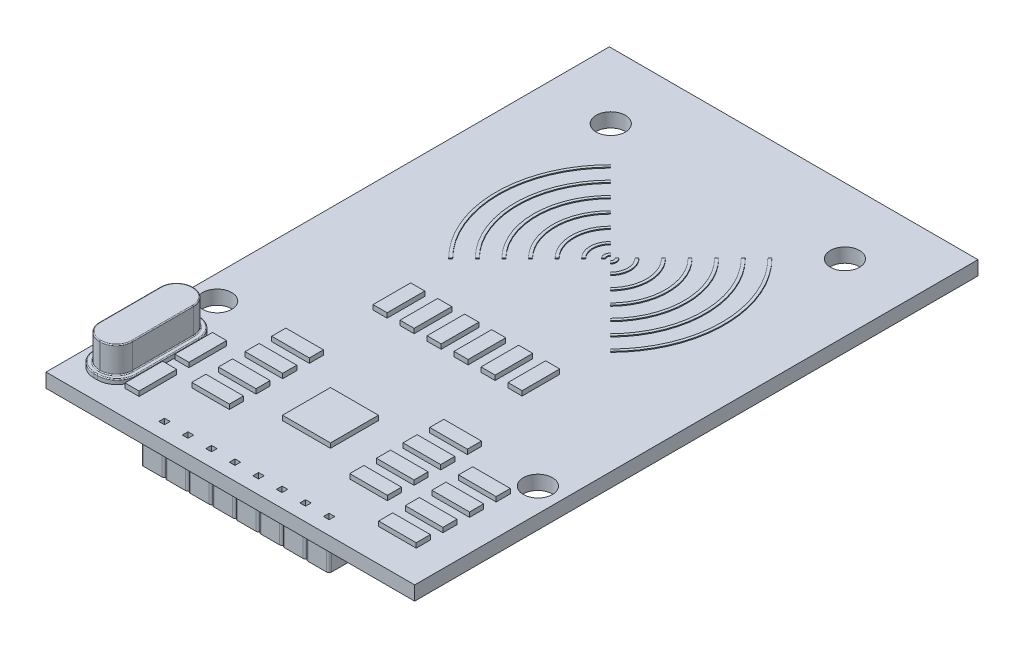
SolidWorks part; units mm, degrees
ref_plane "Front Plane" through (0, 0, 0) normal (0, 0, 1) x (1, 0, 0)
ref_plane "Top Plane" through (0, 0, 0) normal (0, 1, 0) x (1, 0, 0)
ref_plane "Right Plane" through (0, 0, 0) normal (1, 0, 0) x (0, 0, -1)
sketch "Sketch1" plane through (0, 0, 0) normal (0, 1, 0) x (1, 0, 0)
  line L1 (-19.6, 29.95) -> (19.6, 29.95)
  line L2 (-19.6, 29.95) -> (-19.6, -29.95)
  line L3 (-19.6, -29.95) -> (19.6, -29.95)
  line L4 (19.6, 29.95) -> (19.6, -29.95)
  line L5 (-19.6, 29.95) -> (19.6, -29.95) construction
  line L6 (-19.6, -29.95) -> (19.6, 29.95) construction
  point P0 (0, 0)
  dimension "D1" = 39.2
  dimension "D2" = 59.9
extrude "Boss-Extrude1" add sketch "Sketch1" along normal blind 1.5
sketch "Sketch3" plane through (0, 1.5, 0) normal (0, 1, 0) x (1, 0, 0)
  line L0 (0, 29.95) -> (0, -29.95) construction
  line L2 (19.6, 29.95) -> (-19.6, 29.95) construction
  line L3 (-17.05, -14.3) -> (17.05, -14.3) construction
  line L4 (-12.45, 22.95) -> (12.45, 22.95) construction
  line L5 (-19.6, -29.95) -> (19.6, -29.95) construction
  circle A0 centre (12.45, 22.95) radius 1.55
  circle A1 centre (-12.45, 22.95) radius 1.55
  circle A2 centre (17.05, -14.3) radius 1.55
  circle A3 centre (-17.05, -14.3) radius 1.55
  point P16 (0, 22.95)
  point P17 (0, -14.3)
  dimension "D1" = 3.1
  dimension "D2" = 12.45
  dimension "D3" = 7
  dimension "D6" = 17.05
  dimension "D7" = 15.65
extrude "Cut-Extrude1" cut sketch "Sketch3" against normal up to surface (1.5 mm away)
sketch "Sketch4" plane through (0, 0, 0) normal (0, 1, 0) x (1, 0, 0)
  line L0 (-19.6, -29.95) -> (19.6, -29.95) construction
  line L1 (-9.75, -26.95) -> (-7.75, -26.95)
  line L2 (-10, -27.2) -> (-10, -29.2)
  line L3 (-9.75, -29.45) -> (-7.75, -29.45)
  line L5 (-19.6, 29.95) -> (-19.6, -29.95) construction
  line L7 (-7.25, -29.45) -> (-5.25, -29.45)
  line L9 (-7.25, -26.95) -> (-5.25, -26.95)
  line L11 (-4.75, -29.45) -> (-2.75, -29.45)
  line L13 (-4.75, -26.95) -> (-2.75, -26.95)
  line L15 (-2.25, -29.45) -> (-0.25, -29.45)
  line L17 (-2.25, -26.95) -> (-0.25, -26.95)
  line L19 (0.25, -29.45) -> (2.25, -29.45)
  line L21 (0.25, -26.95) -> (2.25, -26.95)
  line L23 (2.75, -29.45) -> (4.75, -29.45)
  line L25 (2.75, -26.95) -> (4.75, -26.95)
  line L27 (5.25, -29.45) -> (7.25, -29.45)
  line L29 (5.25, -26.95) -> (7.25, -26.95)
  line L30 (10, -27.2) -> (10, -29.2)
  line L31 (7.75, -29.45) -> (9.75, -29.45)
  line L33 (7.75, -26.95) -> (9.75, -26.95)
  line L34 (-7.5, -27.2) -> (-7.5, -29.2)
  line L35 (-5, -27.2) -> (-5, -29.2)
  line L36 (-2.5, -27.2) -> (-2.5, -29.2)
  line L37 (0, -27.2) -> (0, -29.2)
  line L38 (2.5, -27.2) -> (2.5, -29.2)
  line L39 (5, -27.2) -> (5, -29.2)
  line L40 (7.5, -27.2) -> (7.5, -29.2)
  arc A1 (-7.75, -26.95) -> (-7.5, -27.2) centre (-7.75, -27.2) cw
  arc A2 (-7.5, -29.2) -> (-7.75, -29.45) centre (-7.75, -29.2) cw
  arc A3 (-9.75, -29.45) -> (-10, -29.2) centre (-9.75, -29.2) cw
  arc A4 (-10, -27.2) -> (-9.75, -26.95) centre (-9.75, -27.2) cw
  arc A5 (-5, -29.2) -> (-5.25, -29.45) centre (-5.25, -29.2) cw
  arc A6 (-7.25, -29.45) -> (-7.5, -29.2) centre (-7.25, -29.2) cw
  arc A7 (-7.5, -27.2) -> (-7.25, -26.95) centre (-7.25, -27.2) cw
  arc A8 (-5.25, -26.95) -> (-5, -27.2) centre (-5.25, -27.2) cw
  arc A10 (-2.5, -29.2) -> (-2.75, -29.45) centre (-2.75, -29.2) cw
  arc A11 (-4.75, -29.45) -> (-5, -29.2) centre (-4.75, -29.2) cw
  arc A12 (-5, -27.2) -> (-4.75, -26.95) centre (-4.75, -27.2) cw
  arc A13 (-2.75, -26.95) -> (-2.5, -27.2) centre (-2.75, -27.2) cw
  arc A15 (0, -29.2) -> (-0.25, -29.45) centre (-0.25, -29.2) cw
  arc A16 (-2.25, -29.45) -> (-2.5, -29.2) centre (-2.25, -29.2) cw
  arc A17 (-2.5, -27.2) -> (-2.25, -26.95) centre (-2.25, -27.2) cw
  arc A18 (-0.25, -26.95) -> (0, -27.2) centre (-0.25, -27.2) cw
  arc A20 (2.5, -29.2) -> (2.25, -29.45) centre (2.25, -29.2) cw
  arc A21 (0.25, -29.45) -> (0, -29.2) centre (0.25, -29.2) cw
  arc A22 (0, -27.2) -> (0.25, -26.95) centre (0.25, -27.2) cw
  arc A23 (2.25, -26.95) -> (2.5, -27.2) centre (2.25, -27.2) cw
  arc A25 (5, -29.2) -> (4.75, -29.45) centre (4.75, -29.2) cw
  arc A26 (2.75, -29.45) -> (2.5, -29.2) centre (2.75, -29.2) cw
  arc A27 (2.5, -27.2) -> (2.75, -26.95) centre (2.75, -27.2) cw
  arc A28 (4.75, -26.95) -> (5, -27.2) centre (4.75, -27.2) cw
  arc A30 (7.5, -29.2) -> (7.25, -29.45) centre (7.25, -29.2) cw
  arc A31 (5.25, -29.45) -> (5, -29.2) centre (5.25, -29.2) cw
  arc A32 (5, -27.2) -> (5.25, -26.95) centre (5.25, -27.2) cw
  arc A33 (7.25, -26.95) -> (7.5, -27.2) centre (7.25, -27.2) cw
  arc A35 (10, -29.2) -> (9.75, -29.45) centre (9.75, -29.2) cw
  arc A36 (7.75, -29.45) -> (7.5, -29.2) centre (7.75, -29.2) cw
  arc A37 (7.5, -27.2) -> (7.75, -26.95) centre (7.75, -27.2) cw
  arc A38 (9.75, -26.95) -> (10, -27.2) centre (9.75, -27.2) cw
  point P12 (-7.5, -26.95)
  point P17 (-10, -29.45)
  point P20 (-10, -26.95)
  dimension "D7" = 0.25
  dimension "D1" = 2.5
  dimension "D2" = 2.5
  dimension "D3" = 0.5
  dimension "D4" = 9.6
  dimension "D8" = 8
extrude "Boss-Extrude3" add sketch "Sketch4" against normal blind 2.5
sketch "Sketch5" plane through (0, -2.5, 0) normal (0, -1, 0) x (-1, 0, 0)
  line L0 (-10, -29.2) -> (-10, -27.2) construction
  line L2 (7.75, -26.95) -> (9.75, -26.95) construction
  line L3 (-9.05, -27.9) -> (-8.45, -27.9)
  line L4 (-9.05, -27.9) -> (-9.05, -28.5)
  line L5 (-9.05, -28.5) -> (-8.45, -28.5)
  line L6 (-8.45, -27.9) -> (-8.45, -28.5)
  line L8 (-6.55, -27.9) -> (-5.95, -27.9)
  line L9 (-5.95, -27.9) -> (-5.95, -28.5)
  line L10 (-6.55, -28.5) -> (-5.95, -28.5)
  line L11 (-6.55, -27.9) -> (-6.55, -28.5)
  line L12 (-4.05, -27.9) -> (-3.45, -27.9)
  line L13 (-3.45, -27.9) -> (-3.45, -28.5)
  line L14 (-4.05, -28.5) -> (-3.45, -28.5)
  line L15 (-4.05, -27.9) -> (-4.05, -28.5)
  line L16 (-1.55, -27.9) -> (-0.95, -27.9)
  line L17 (-0.95, -27.9) -> (-0.95, -28.5)
  line L18 (-1.55, -28.5) -> (-0.95, -28.5)
  line L19 (-1.55, -27.9) -> (-1.55, -28.5)
  line L20 (0.95, -27.9) -> (1.55, -27.9)
  line L21 (1.55, -27.9) -> (1.55, -28.5)
  line L22 (0.95, -28.5) -> (1.55, -28.5)
  line L23 (0.95, -27.9) -> (0.95, -28.5)
  line L24 (3.45, -27.9) -> (4.05, -27.9)
  line L25 (4.05, -27.9) -> (4.05, -28.5)
  line L26 (3.45, -28.5) -> (4.05, -28.5)
  line L27 (3.45, -27.9) -> (3.45, -28.5)
  line L28 (5.95, -27.9) -> (6.55, -27.9)
  line L29 (6.55, -27.9) -> (6.55, -28.5)
  line L30 (5.95, -28.5) -> (6.55, -28.5)
  line L31 (5.95, -27.9) -> (5.95, -28.5)
  line L32 (8.45, -27.9) -> (9.05, -27.9)
  line L33 (9.05, -27.9) -> (9.05, -28.5)
  line L34 (8.45, -28.5) -> (9.05, -28.5)
  line L35 (8.45, -27.9) -> (8.45, -28.5)
  dimension "D1" = 0.6
  dimension "D2" = 0.6
  dimension "D3" = 0.95
  dimension "D4" = 0.95
  dimension "D5" = 8
extrude "Cut-Extrude2" cut sketch "Sketch5" against normal up to surface (4 mm away)
sketch "Sketch8" plane through (0, 1.5, 0) normal (0, 1, 0) x (1, 0, 0)
  line L0 (-19.6, -29.95) -> (19.6, -29.95) construction
  line L1 (-16.5, -17.15) -> (-16.15, -17.15)
  line L2 (-18.6, -19.25) -> (-18.6, -25.85)
  line L3 (-16.5, -27.95) -> (-16.15, -27.95)
  line L4 (-14.05, -19.25) -> (-14.05, -25.85)
  line L6 (-19.6, 29.95) -> (-19.6, -29.95) construction
  arc A0 (-18.6, -25.85) -> (-16.5, -27.95) centre (-16.5, -25.85) ccw
  arc A1 (-16.15, -27.95) -> (-14.05, -25.85) centre (-16.15, -25.85) ccw
  arc A2 (-16.15, -17.15) -> (-14.05, -19.25) centre (-16.15, -19.25) cw
  arc A3 (-16.5, -17.15) -> (-18.6, -19.25) centre (-16.5, -19.25) ccw
  point P6 (-18.6, -27.95)
  point P11 (-14.05, -17.15)
  point P14 (-18.6, -17.15)
  dimension "D3" = 2.1
  dimension "D1" = 10.8
  dimension "D2" = 4.55
  dimension "D4" = 1
  dimension "D5" = 2
extrude "Boss-Extrude4" add sketch "Sketch8" along normal blind 0.5
sketch "Sketch10" plane through (0, 2, 0) normal (0, 1, 0) x (1, 0, 0)
  line L0 (-16.325, -17.15) -> (-16.325, -27.95) construction
  line L1 (-16.15, -17.15) -> (-16.5, -17.15) construction
  line L2 (-16.5, -27.95) -> (-16.15, -27.95) construction
  line L3 (-18.6, -22.55) -> (-14.05, -22.55) construction
  line L4 (-18.6, -19.25) -> (-18.6, -25.85) construction
  line L5 (-14.05, -25.85) -> (-14.05, -19.25) construction
  line L7 (-16.375, -17.6) -> (-16.275, -17.6)
  line L8 (-18.075, -19.3) -> (-18.075, -25.8)
  line L9 (-16.375, -27.5) -> (-16.275, -27.5)
  line L10 (-14.575, -19.3) -> (-14.575, -25.8)
  line L11 (-18.075, -17.6) -> (-14.575, -27.5) construction
  line L12 (-18.075, -27.5) -> (-14.575, -17.6) construction
  arc A0 (-18.075, -25.8) -> (-16.375, -27.5) centre (-16.375, -25.8) ccw
  arc A1 (-16.275, -27.5) -> (-14.575, -25.8) centre (-16.275, -25.8) ccw
  arc A2 (-14.575, -19.3) -> (-16.275, -17.6) centre (-16.275, -19.3) ccw
  arc A3 (-16.375, -17.6) -> (-18.075, -19.3) centre (-16.375, -19.3) ccw
  point P12 (-16.325, -22.55)
  dimension "D3" = 1.7
  dimension "D1" = 3.5
  dimension "D2" = 9.9
extrude "Boss-Extrude5" add sketch "Sketch10" along normal blind 2.8
fillet "Fillet1" radius 0.1 24 edges at (-17.5771, 4.8, 18.0979) (-16.325, 4.8, 17.6) (-15.0729, 4.8, 18.0979) (-14.575, 4.8, 22.55) (-15.0729, 4.8, 27.0021) (-16.325, 4.8, 27.5) (-17.5771, 4.8, 27.0021) (-17.5771, 2, 18.0979) (-16.325, 2, 17.6) (-15.0729, 2, 18.0979) (-14.575, 2, 22.55) (-15.0729, 2, 27.0021) (-16.325, 2, 27.5) (-17.5771, 2, 27.0021) (-17.9849, 2, 17.7651) (-16.325, 2, 17.15) (-14.6651, 2, 17.7651) (-14.05, 2, 22.55) (-14.6651, 2, 27.3349) (-16.325, 2, 27.95) (-17.9849, 2, 27.3349) (-18.075, 4.8, 22.55) (-18.075, 2, 22.55) (-18.6, 2, 22.55)
sketch "Sketch11" plane through (0, 1.5, 0) normal (0, 1, 0) x (1, 0, 0)
  line L0 (-0.2475, 10.6975) -> (-0.4596, 10.9096)
  line L1 (-0.35, 10.45) -> (-19.6, 10.45) construction
  line L2 (-19.6, 29.95) -> (-19.6, -29.95) construction
  line L3 (19.6, 29.95) -> (-19.6, 29.95) construction
  line L4 (0.2475, 10.6975) -> (0.4596, 10.9096)
  line L5 (-0.2475, 10.2025) -> (-0.4596, 9.9904)
  line L6 (0.2475, 10.2025) -> (0.4596, 9.9904)
  line L7 (-8.4853, 18.9353) -> (-8.5913, 19.0413)
  line L8 (-8.5913, 1.8587) -> (-8.4853, 1.9647)
  line L9 (8.4853, 1.9647) -> (8.5913, 1.8587)
  line L10 (8.4853, 18.9353) -> (8.5913, 19.0413)
  line L11 (-8.3792, 18.8292) -> (-8.4853, 18.9353)
  line L12 (-6.965, 17.415) -> (-7.1771, 17.6271)
  line L13 (-5.5508, 16.0008) -> (-5.7629, 16.2129)
  line L14 (-4.1366, 14.5866) -> (-4.3487, 14.7987)
  line L15 (-2.7224, 13.1724) -> (-2.9345, 13.3845)
  line L16 (-1.3081, 11.7581) -> (-1.5203, 11.9703)
  line L17 (-1.3081, 9.1419) -> (-1.5203, 8.9297)
  line L18 (-2.7224, 7.7276) -> (-2.9345, 7.5155)
  line L19 (-4.1366, 6.3134) -> (-4.3487, 6.1013)
  line L20 (-5.5508, 4.8992) -> (-5.7629, 4.6871)
  line L21 (-8.3792, 2.0708) -> (-8.4853, 1.9647)
  line L22 (1.3081, 9.1419) -> (1.5203, 8.9297)
  line L23 (2.7224, 7.7276) -> (2.9345, 7.5155)
  line L24 (4.1366, 6.3134) -> (4.3487, 6.1013)
  line L25 (5.5508, 4.8992) -> (5.7629, 4.6871)
  line L26 (6.965, 3.485) -> (7.1771, 3.2729)
  line L27 (8.3792, 2.0708) -> (8.4853, 1.9647)
  line L28 (1.3081, 11.7581) -> (1.5203, 11.9703)
  line L29 (2.7224, 13.1724) -> (2.9345, 13.3845)
  line L30 (4.1366, 14.5866) -> (4.3487, 14.7987)
  line L31 (5.5508, 16.0008) -> (5.7629, 16.2129)
  line L32 (6.965, 17.415) -> (7.1771, 17.6271)
  line L33 (8.3792, 18.8292) -> (8.4853, 18.9353)
  line L34 (-6.965, 3.485) -> (-7.1771, 3.2729)
  line L35 (0, 10.45) -> (0, 29.95) construction
  arc A0 (-0.3536, 10.8036) -> (-0.3536, 10.0964) centre (0, 10.45) ccw construction
  arc A1 (-1.4142, 11.8642) -> (-1.4142, 9.0358) centre (0, 10.45) ccw construction
  arc A2 (-2.8284, 13.2784) -> (-2.8284, 7.6216) centre (0, 10.45) ccw construction
  arc A3 (-4.2426, 14.6926) -> (-4.2426, 6.2074) centre (0, 10.45) ccw construction
  arc A4 (-5.6569, 16.1069) -> (-5.6569, 4.7931) centre (0, 10.45) ccw construction
  arc A5 (-5.6569, 16.1069) -> (-5.6569, 4.7931) centre (0, 10.45) ccw
  arc A6 (-7.0711, 17.5211) -> (-7.0711, 3.3789) centre (0, 10.45) ccw construction
  arc A7 (-8.4853, 18.9353) -> (-8.4853, 1.9647) centre (0, 10.45) ccw construction
  arc A8 (0.3536, 10.0964) -> (0.3536, 10.8036) centre (0, 10.45) ccw construction
  arc A9 (1.4142, 9.0358) -> (1.4142, 11.8642) centre (0, 10.45) ccw construction
  arc A10 (2.8284, 7.6216) -> (2.8284, 13.2784) centre (0, 10.45) ccw construction
  arc A11 (4.2426, 6.2074) -> (4.2426, 14.6926) centre (0, 10.45) ccw construction
  arc A12 (5.6569, 4.7931) -> (5.6569, 16.1069) centre (0, 10.45) ccw construction
  arc A13 (5.6569, 4.7931) -> (5.6569, 16.1069) centre (0, 10.45) ccw
  arc A14 (7.0711, 3.3789) -> (7.0711, 17.5211) centre (0, 10.45) ccw construction
  arc A15 (8.4853, 1.9647) -> (8.4853, 18.9353) centre (0, 10.45) ccw construction
  arc A16 (-8.5913, 19.0413) -> (-8.5913, 1.8587) centre (0, 10.45) ccw
  arc A17 (-7.1771, 17.6271) -> (-7.1771, 3.2729) centre (0, 10.45) ccw
  arc A18 (-5.7629, 16.2129) -> (-5.7629, 4.6871) centre (0, 10.45) ccw
  arc A19 (-4.3487, 14.7987) -> (-4.3487, 6.1013) centre (0, 10.45) ccw
  arc A20 (-2.9345, 13.3845) -> (-2.9345, 7.5155) centre (0, 10.45) ccw
  arc A21 (-1.5203, 11.9703) -> (-1.5203, 8.9297) centre (0, 10.45) ccw
  arc A22 (-0.4596, 10.9096) -> (-0.4596, 9.9904) centre (0, 10.45) ccw
  arc A23 (0.4596, 9.9904) -> (0.4596, 10.9096) centre (0, 10.45) ccw
  arc A24 (1.5203, 8.9297) -> (1.5203, 11.9703) centre (0, 10.45) ccw
  arc A25 (2.9345, 7.5155) -> (2.9345, 13.3845) centre (0, 10.45) ccw
  arc A26 (4.3487, 6.1013) -> (4.3487, 14.7987) centre (0, 10.45) ccw
  arc A27 (5.7629, 4.6871) -> (5.7629, 16.2129) centre (0, 10.45) ccw
  arc A28 (7.1771, 3.2729) -> (7.1771, 17.6271) centre (0, 10.45) ccw
  arc A29 (8.5913, 1.8587) -> (8.5913, 19.0413) centre (0, 10.45) ccw
  arc A30 (-8.3792, 18.8292) -> (-8.3792, 2.0708) centre (0, 10.45) ccw
  arc A31 (-6.965, 17.415) -> (-6.965, 3.485) centre (0, 10.45) ccw
  arc A32 (-5.5508, 16.0008) -> (-5.5508, 4.8992) centre (0, 10.45) ccw
  arc A33 (-4.1366, 14.5866) -> (-4.1366, 6.3134) centre (0, 10.45) ccw
  arc A34 (-2.7224, 13.1724) -> (-2.7224, 7.7276) centre (0, 10.45) ccw
  arc A35 (-1.3081, 11.7581) -> (-1.3081, 9.1419) centre (0, 10.45) ccw
  arc A36 (-0.2475, 10.6975) -> (-0.2475, 10.2025) centre (0, 10.45) ccw
  arc A37 (0.2475, 10.2025) -> (0.2475, 10.6975) centre (0, 10.45) ccw
  arc A38 (1.3081, 9.1419) -> (1.3081, 11.7581) centre (0, 10.45) ccw
  arc A39 (2.7224, 7.7276) -> (2.7224, 13.1724) centre (0, 10.45) ccw
  arc A40 (4.1366, 6.3134) -> (4.1366, 14.5866) centre (0, 10.45) ccw
  arc A41 (5.5508, 4.8992) -> (5.5508, 16.0008) centre (0, 10.45) ccw
  arc A42 (6.965, 3.485) -> (6.965, 17.415) centre (0, 10.45) ccw
  arc A43 (8.3792, 2.0708) -> (8.3792, 18.8292) centre (0, 10.45) ccw
  dimension "D1" = 45
  dimension "D2" = 0.5
  dimension "D3" = 2
  dimension "D4" = 6
  dimension "D5" = 10
  dimension "D6" = 19.5
  dimension "D10" = 8
  dimension "D11" = 4
  dimension "D12" = 12
  dimension "D7" = 45
  dimension "D8" = 45
  dimension "D9" = 45
  dimension "D13" = 0.15
  dimension "D14" = 0.15
extrude "Boss-Extrude6" add sketch "Sketch11" along normal blind 0.1 contours A16 L8 L21 A30 L11 L7 | A17 L34 A31 L12 | A18 L20 A32 L13 | A19 L19 A33 L14 | A20 L18 A34 L15 | A35 L17 A21 L16 | A36 L5 A22 L0 | A23 L4 A37 L6 | A24 L28 A38 L22 | A25 L29 A39 L23 | A26 L30 A40 L24 | A27 L31 A41 L25 | A28 L32 A42 L26 | A29 L10 L33 A43 L27 L9
sketch "Esboço1" plane through (0, 1.5, 0) normal (0, 1, 0) x (1, 0, 0)
  line L0 (6.425, -4.85) -> (5.055, -4.85) construction
  line L1 (6.425, -2.85) -> (7.925, -2.85)
  line L2 (6.425, -2.85) -> (6.425, -6.85)
  line L3 (6.425, -6.85) -> (7.925, -6.85)
  line L4 (7.925, -2.85) -> (7.925, -6.85)
  line L5 (3.555, -4.85) -> (2.185, -4.85) construction
  line L6 (5.055, -2.85) -> (3.555, -2.85)
  line L7 (5.055, -2.85) -> (5.055, -6.85)
  line L8 (5.055, -6.85) -> (3.555, -6.85)
  line L9 (3.555, -2.85) -> (3.555, -6.85)
  line L10 (2.185, -2.85) -> (0.685, -2.85)
  line L11 (2.185, -2.85) -> (2.185, -6.85)
  line L12 (2.185, -6.85) -> (0.685, -6.85)
  line L13 (0.685, -2.85) -> (0.685, -6.85)
  line L14 (-0.685, -2.85) -> (-2.185, -2.85)
  line L15 (-0.685, -2.85) -> (-0.685, -6.85)
  line L16 (-0.685, -6.85) -> (-2.185, -6.85)
  line L17 (-2.185, -2.85) -> (-2.185, -6.85)
  line L18 (-3.555, -2.85) -> (-5.055, -2.85)
  line L19 (-3.555, -2.85) -> (-3.555, -6.85)
  line L20 (-3.555, -6.85) -> (-5.055, -6.85)
  line L21 (-5.055, -2.85) -> (-5.055, -6.85)
  line L22 (-6.425, -2.85) -> (-7.925, -2.85)
  line L23 (-6.425, -2.85) -> (-6.425, -6.85)
  line L24 (-6.425, -6.85) -> (-7.925, -6.85)
  line L25 (-7.925, -2.85) -> (-7.925, -6.85)
  line L26 (-8.4, -22.15) -> (-8.4, -20.8167) construction
  line L27 (0.685, -4.85) -> (-0.685, -4.85) construction
  line L28 (-8.4, -19.3167) -> (-8.4, -17.9833) construction
  line L29 (-2.185, -4.85) -> (-3.555, -4.85) construction
  line L30 (-8.4, -16.4833) -> (-8.4, -15.15) construction
  line L31 (-5.055, -4.85) -> (-6.425, -4.85) construction
  line L32 (0, 0) -> (0, -18.65) construction
  line L33 (19.6, 29.95) -> (-19.6, 29.95) construction
  line L34 (8.4, -22.15) -> (8.4, -20.8167) construction
  line L35 (-10.4, -23.65) -> (-6.4, -23.65)
  line L36 (-10.4, -23.65) -> (-10.4, -22.15)
  line L37 (-10.4, -22.15) -> (-6.4, -22.15)
  line L38 (-6.4, -23.65) -> (-6.4, -22.15)
  line L39 (-10.4, -19.3167) -> (-6.4, -19.3167)
  line L40 (-10.4, -19.3167) -> (-10.4, -20.8167)
  line L41 (-10.4, -20.8167) -> (-6.4, -20.8167)
  line L42 (-6.4, -19.3167) -> (-6.4, -20.8167)
  line L43 (-10.4, -16.4833) -> (-6.4, -16.4833)
  line L44 (-10.4, -16.4833) -> (-10.4, -17.9833)
  line L45 (-10.4, -17.9833) -> (-6.4, -17.9833)
  line L46 (-6.4, -16.4833) -> (-6.4, -17.9833)
  line L47 (-10.4, -13.65) -> (-6.4, -13.65)
  line L48 (-10.4, -13.65) -> (-10.4, -15.15)
  line L49 (-10.4, -15.15) -> (-6.4, -15.15)
  line L50 (-6.4, -13.65) -> (-6.4, -15.15)
  line L51 (6.4, -13.65) -> (10.4, -13.65)
  line L52 (6.4, -13.65) -> (6.4, -15.15)
  line L53 (6.4, -15.15) -> (10.4, -15.15)
  line L54 (10.4, -13.65) -> (10.4, -15.15)
  line L55 (6.4, -16.4833) -> (10.4, -16.4833)
  line L56 (6.4, -16.4833) -> (6.4, -17.9833)
  line L57 (6.4, -17.9833) -> (10.4, -17.9833)
  line L58 (10.4, -16.4833) -> (10.4, -17.9833)
  line L59 (6.4, -19.3167) -> (10.4, -19.3167)
  line L60 (6.4, -19.3167) -> (6.4, -20.8167)
  line L61 (6.4, -20.8167) -> (10.4, -20.8167)
  line L62 (10.4, -19.3167) -> (10.4, -20.8167)
  line L63 (6.4, -22.15) -> (10.4, -22.15)
  line L64 (6.4, -22.15) -> (6.4, -23.65)
  line L65 (6.4, -23.65) -> (10.4, -23.65)
  line L66 (10.4, -22.15) -> (10.4, -23.65)
  line L67 (8.4, -19.3167) -> (8.4, -17.9833) construction
  line L68 (-8.4, -18.65) -> (8.4, -18.65) construction
  line L69 (8.4, -16.4833) -> (8.4, -15.15) construction
  line L70 (-19.6, 29.95) -> (-19.6, -29.95) construction
  line L71 (-13.15, -21.95) -> (-13.15, -23.25) construction
  line L72 (-13.9, -17.95) -> (-12.4, -17.95)
  line L73 (-13.9, -17.95) -> (-13.9, -21.95)
  line L74 (-13.9, -21.95) -> (-12.4, -21.95)
  line L75 (-12.4, -17.95) -> (-12.4, -21.95)
  line L76 (-13.9, -23.25) -> (-12.4, -23.25)
  line L77 (-13.9, -23.25) -> (-13.9, -27.25)
  line L78 (-13.9, -27.25) -> (-12.4, -27.25)
  line L79 (-12.4, -23.25) -> (-12.4, -27.25)
  line L80 (-19.6, -29.95) -> (19.6, -29.95) construction
  line L81 (14.3, -17.9833) -> (14.3, -19.3167) construction
  line L82 (12.3, -16.4833) -> (16.3, -16.4833)
  line L83 (12.3, -16.4833) -> (12.3, -17.9833)
  line L84 (12.3, -17.9833) -> (16.3, -17.9833)
  line L85 (16.3, -16.4833) -> (16.3, -17.9833)
  line L86 (12.3, -19.3167) -> (16.3, -19.3167)
  line L87 (12.3, -19.3167) -> (12.3, -20.8167)
  line L88 (12.3, -20.8167) -> (16.3, -20.8167)
  line L89 (16.3, -19.3167) -> (16.3, -20.8167)
  line L90 (12.3, -22.15) -> (16.3, -22.15)
  line L91 (12.3, -22.15) -> (12.3, -23.65)
  line L92 (12.3, -23.65) -> (16.3, -23.65)
  line L93 (16.3, -22.15) -> (16.3, -23.65)
  line L94 (12.3, -24.9833) -> (16.3, -24.9833)
  line L95 (12.3, -24.9833) -> (12.3, -26.4833)
  line L96 (12.3, -26.4833) -> (16.3, -26.4833)
  line L97 (16.3, -24.9833) -> (16.3, -26.4833)
  line L98 (14.3, -20.8167) -> (14.3, -22.15) construction
  line L99 (14.3, -23.65) -> (14.3, -24.9833) construction
  line L100 (19.6, -29.95) -> (19.6, 29.95) construction
  point P34 (0, -4.85)
  point P86 (0, -18.65)
  dimension "D1" = 1.5
  dimension "D2" = 4
  dimension "D3" = 1.37
  dimension "D4" = 32.8
  dimension "D5" = 43.6
  dimension "D6" = 10
  dimension "D7" = 9.2
  dimension "D8" = 9.3
  dimension "D9" = 7.2
  dimension "D10" = 12
  dimension "D11" = 3.3
extrude "Ressalto-extrusão1" add sketch "Esboço1" along normal blind 0.5
sketch "Esboço2" plane through (0, 1.5, 0) normal (0, 1, 0) x (1, 0, 0)
  line L0 (0, 0) -> (0, -16.75) construction
  line L1 (-2.55, -16.75) -> (2.55, -16.75)
  line L2 (-2.55, -16.75) -> (-2.55, -21.85)
  line L3 (-2.55, -21.85) -> (2.55, -21.85)
  line L4 (2.55, -16.75) -> (2.55, -21.85)
  line L5 (19.6, 29.95) -> (-19.6, 29.95) construction
  dimension "D1" = 5.1
  dimension "D2" = 46.7
extrude "Ressalto-extrusão2" add sketch "Esboço2" along normal blind 0.5
